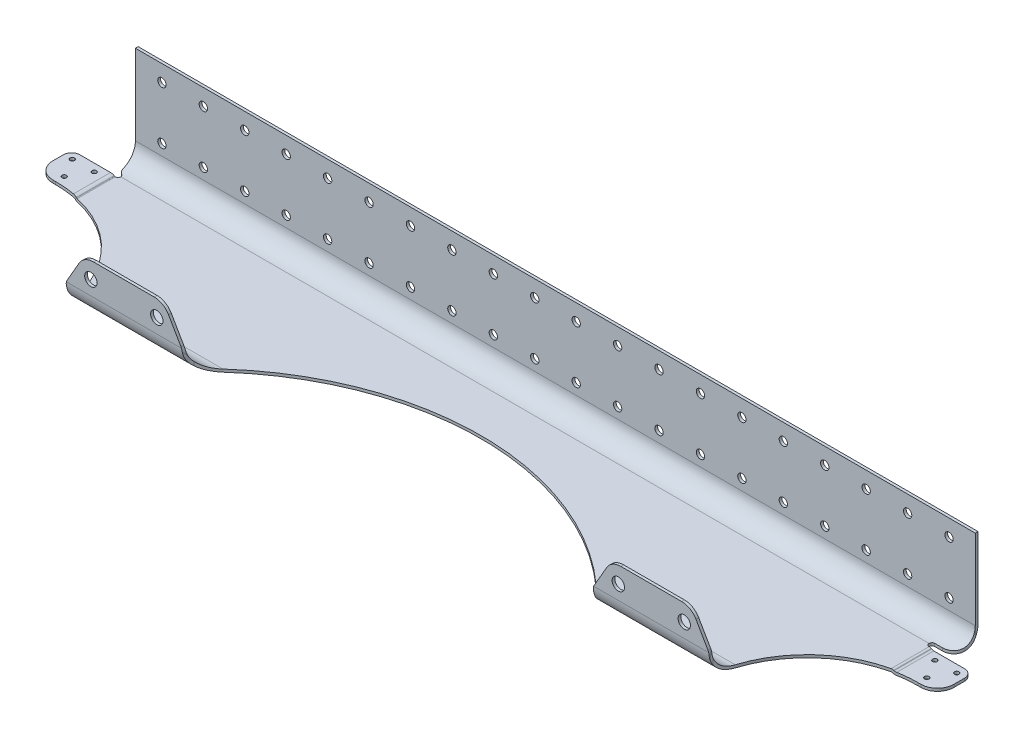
SolidWorks part; units mm, degrees
ref_plane "Front Plane" through (0, 0, 0) normal (1, 0, 0) x (0, 1, 0)
ref_plane "Top Plane" through (0, 0, 0) normal (0, 0, 1) x (0, 1, 0)
ref_plane "Right Plane" through (0, 0, 0) normal (0, 1, 0) x (-1, 0, 0)
sketch "sk 5dia hole pat" plane through (0, 0, 0) normal (0, 0, 1) x (0, 1, 0)
  line L4 (-30.48, -48.26) -> (30.48, -48.26) construction
  point P3 (0, -48.26)
  circle B0 centre (30.48, -579.12) radius 4.826
  circle B1 centre (1188.72, 579.12) radius 4.826
  circle B2 centre (78.74, -579.12) radius 4.826
  circle B3 centre (127, -579.12) radius 4.826
  circle B4 centre (175.26, -579.12) radius 4.826
  circle B5 centre (223.52, -579.12) radius 4.826
  circle B6 centre (271.78, -579.12) radius 4.826
  circle B7 centre (320.04, -579.12) radius 4.826
  circle B8 centre (368.3, -579.12) radius 4.826
  circle B9 centre (416.56, -579.12) radius 4.826
  circle B10 centre (464.82, -579.12) radius 4.826
  circle B11 centre (513.08, -579.12) radius 4.826
  circle B12 centre (561.34, -579.12) radius 4.826
  circle B13 centre (609.6, -579.12) radius 4.826
  circle B14 centre (657.86, -579.12) radius 4.826
  circle B15 centre (706.12, -579.12) radius 4.826
  circle B16 centre (754.38, -579.12) radius 4.826
  circle B17 centre (802.64, -579.12) radius 4.826
  circle B18 centre (850.9, -579.12) radius 4.826
  circle B19 centre (899.16, -579.12) radius 4.826
  circle B20 centre (947.42, -579.12) radius 4.826
  circle B21 centre (995.68, -579.12) radius 4.826
  circle B22 centre (1043.94, -579.12) radius 4.826
  circle B23 centre (1092.2, -579.12) radius 4.826
  circle B24 centre (1140.46, -579.12) radius 4.826
  circle B25 centre (1188.72, -579.12) radius 4.826
  circle B26 centre (30.48, -530.86) radius 4.826
  circle B27 centre (30.48, -482.6) radius 4.826
  circle B28 centre (30.48, -434.34) radius 4.826
  circle B29 centre (30.48, -386.08) radius 4.826
  circle B30 centre (30.48, -337.82) radius 4.826
  circle B31 centre (30.48, -289.56) radius 4.826
  circle B32 centre (30.48, -241.3) radius 4.826
  circle B33 centre (30.48, -193.04) radius 4.826
  circle B34 centre (30.48, -144.78) radius 4.826
  circle B35 centre (30.48, -96.52) radius 4.826
  circle B36 centre (30.48, -48.26) radius 4.826
  circle B37 centre (30.48, 0) radius 4.826
  circle B38 centre (30.48, 48.26) radius 4.826
  circle B39 centre (30.48, 96.52) radius 4.826
  circle B40 centre (30.48, 144.78) radius 4.826
  circle B41 centre (30.48, 193.04) radius 4.826
  circle B42 centre (30.48, 241.3) radius 4.826
  circle B43 centre (30.48, 289.56) radius 4.826
  circle B44 centre (30.48, 337.82) radius 4.826
  circle B45 centre (30.48, 386.08) radius 4.826
  circle B46 centre (30.48, 434.34) radius 4.826
  circle B47 centre (30.48, 482.6) radius 4.826
  circle B48 centre (30.48, 530.86) radius 4.826
  circle B49 centre (30.48, 579.12) radius 4.826
  circle B50 centre (1140.46, 579.12) radius 4.826
  circle B51 centre (1092.2, 579.12) radius 4.826
  circle B52 centre (1043.94, 579.12) radius 4.826
  circle B53 centre (995.68, 579.12) radius 4.826
  circle B54 centre (947.42, 579.12) radius 4.826
  circle B55 centre (899.16, 579.12) radius 4.826
  circle B56 centre (850.9, 579.12) radius 4.826
  circle B57 centre (802.64, 579.12) radius 4.826
  circle B58 centre (754.38, 579.12) radius 4.826
  circle B59 centre (706.12, 579.12) radius 4.826
  circle B60 centre (657.86, 579.12) radius 4.826
  circle B61 centre (609.6, 579.12) radius 4.826
  circle B62 centre (561.34, 579.12) radius 4.826
  circle B63 centre (513.08, 579.12) radius 4.826
  circle B64 centre (464.82, 579.12) radius 4.826
  circle B65 centre (416.56, 579.12) radius 4.826
  circle B66 centre (368.3, 579.12) radius 4.826
  circle B67 centre (320.04, 579.12) radius 4.826
  circle B68 centre (271.78, 579.12) radius 4.826
  circle B69 centre (223.52, 579.12) radius 4.826
  circle B70 centre (175.26, 579.12) radius 4.826
  circle B71 centre (127, 579.12) radius 4.826
  circle B72 centre (78.74, 579.12) radius 4.826
  circle B73 centre (1188.72, 530.86) radius 4.826
  circle B74 centre (1188.72, 482.6) radius 4.826
  circle B75 centre (1188.72, 434.34) radius 4.826
  circle B76 centre (1188.72, 386.08) radius 4.826
  circle B77 centre (1188.72, 337.82) radius 4.826
  circle B78 centre (1188.72, 289.56) radius 4.826
  circle B79 centre (1188.72, 241.3) radius 4.826
  circle B80 centre (1188.72, 193.04) radius 4.826
  circle B81 centre (1188.72, 144.78) radius 4.826
  circle B82 centre (1188.72, 96.52) radius 4.826
  circle B83 centre (1188.72, 48.26) radius 4.826
  circle B84 centre (1188.72, 0) radius 4.826
  circle B85 centre (1188.72, -48.26) radius 4.826
  circle B86 centre (1188.72, -96.52) radius 4.826
  circle B87 centre (1188.72, -144.78) radius 4.826
  circle B88 centre (1188.72, -193.04) radius 4.826
  circle B89 centre (1188.72, -241.3) radius 4.826
  circle B90 centre (1188.72, -289.56) radius 4.826
  circle B91 centre (1188.72, -337.82) radius 4.826
  circle B92 centre (1188.72, -386.08) radius 4.826
  circle B93 centre (1188.72, -434.34) radius 4.826
  circle B94 centre (1188.72, -482.6) radius 4.826
  circle B95 centre (1188.72, -530.86) radius 4.826
  line B96 (609.6, -579.12) -> (609.6, -504.12) construction
  line B97 (30.48, 0) -> (105.48, 0) construction
  circle B98 centre (-30.48, 579.12) radius 4.826
  circle B99 centre (-175.26, -579.12) radius 4.826
  circle B100 centre (-127, -579.12) radius 4.826
  circle B101 centre (-30.48, -579.12) radius 4.826
  circle B102 centre (-1188.72, 96.52) radius 4.826
  circle B103 centre (-127, 579.12) radius 4.826
  circle B104 centre (-464.82, 579.12) radius 4.826
  circle B105 centre (-513.08, 579.12) radius 4.826
  circle B106 centre (-706.12, 579.12) radius 4.826
  circle B107 centre (-754.38, 579.12) radius 4.826
  circle B108 centre (-899.16, 579.12) radius 4.826
  circle B109 centre (-30.48, 530.86) radius 4.826
  circle B110 centre (-30.48, 482.6) radius 4.826
  circle B111 centre (-30.48, 434.34) radius 4.826
  circle B112 centre (-30.48, 386.08) radius 4.826
  circle B113 centre (-30.48, 337.82) radius 4.826
  circle B114 centre (-30.48, 289.56) radius 4.826
  circle B115 centre (-30.48, 241.3) radius 4.826
  circle B116 centre (-30.48, 193.04) radius 4.826
  circle B117 centre (-30.48, 144.78) radius 4.826
  circle B118 centre (-30.48, 96.52) radius 4.826
  circle B119 centre (-30.48, 48.26) radius 4.826
  circle B120 centre (-30.48, 0) radius 4.826
  circle B121 centre (-30.48, -48.26) radius 4.826
  circle B122 centre (-30.48, -96.52) radius 4.826
  circle B123 centre (-30.48, -144.78) radius 4.826
  circle B124 centre (-30.48, -241.3) radius 4.826
  circle B125 centre (-30.48, -289.56) radius 4.826
  circle B126 centre (-30.48, -337.82) radius 4.826
  circle B127 centre (-30.48, -386.08) radius 4.826
  circle B128 centre (-30.48, -434.34) radius 4.826
  circle B129 centre (-30.48, -482.6) radius 4.826
  circle B130 centre (-30.48, -530.86) radius 4.826
  line B131 (-1188.72, 0) -> (-1113.72, 0) construction
  dimension "D1" = 60.96
sketch_block_instance "5dia hole pat-1"
sketch_block "5dia hole pat" parameters "D1"=9.652, "D2"=9.652, "D3"=75
sketch_block_instance "5dia hole pat-2"
sketch "sk 47.986in pnl" plane through (0, 0, 0) normal (0, 0, 1) x (0, 1, 0)
  line B0 (0.1778, 0) -> (1219.0222, 0) construction
  line B1 (0.1778, 609.4222) -> (1219.0222, 609.4222)
  line B2 (0.1778, 609.4222) -> (0.1778, -609.4222)
  line B3 (0.1778, -609.4222) -> (1219.0222, -609.4222)
  line B4 (1219.0222, 609.4222) -> (1219.0222, -609.4222)
  line B5 (609.6, 609.4222) -> (609.6, -609.4222) construction
  dimension "D1" = 30.3022
sketch_block_instance "47.986in pnl-1"
sketch_block "47.986in pnl" parameters "D1"=1218.8444, "D2"=1218.8444
sketch "sk main body" plane through (0, 0, 0) normal (1, 0, 0) x (0, 1, 0)
  line L0 (49.53, 0) -> (-43.18, 0)
  line L1 (-68.58, 25.4) -> (-68.58, 158.75)
  line L2 (-43.18, 184.15) -> (-7.62, 184.15)
  line L3 (-26.67, 213.8401) -> (-26.67, 147.2198) construction
  line L4 (49.53, 3.175) -> (-43.18, 3.175)
  line L5 (-65.405, 25.4) -> (-65.405, 158.75)
  line L6 (-43.18, 180.975) -> (-7.62, 180.975)
  line L7 (-7.62, 184.15) -> (-7.62, 180.975)
  line L8 (49.53, 3.175) -> (49.53, 0)
  line L9 (670.3644, 0) -> (-670.3644, 0) construction
  arc A0 (-43.18, 0) -> (-68.58, 25.4) centre (-43.18, 25.4) cw
  arc A1 (-68.58, 158.75) -> (-43.18, 184.15) centre (-43.18, 158.75) cw
  arc A2 (-43.18, 3.175) -> (-65.405, 25.4) centre (-43.18, 25.4) cw
  arc A3 (-65.405, 158.75) -> (-43.18, 180.975) centre (-43.18, 158.75) cw
  dimension "D2" = 25.4
  dimension "D1" = 19.05
  dimension "D3" = 12.7
  dimension "D4" = 16.51
  dimension "D5" = 19.05
  dimension "D7" = 177.8
  dimension "D6" = 3.175
extrude "main body" add sketch "sk main body" along normal mid plane 996.48
sketch "sk upper holes" plane through (0, 0, 184.15) normal (0, 0, 1) x (1, 0, 0)
  line L0 (-609.4222, 0.1778) -> (-609.4222, 1219.0222) construction
  line L1 (609.4222, 0.1778) -> (609.4222, 1219.0222) construction
  line L2 (498.24, -7.62) -> (-498.24, -7.62) construction
  circle A2 centre (-342.9, -26.67) radius 16.51 construction
  circle A3 centre (-266.7, -26.67) radius 16.51 construction
  circle A4 centre (266.7, -26.67) radius 16.51 construction
  circle A5 centre (342.9, -26.67) radius 16.51 construction
  line B0 (-342.9, -26.67) -> (-266.7, -26.67) construction
  circle B1 centre (-342.9, -26.67) radius 7.1438
  circle B2 centre (-266.7, -26.67) radius 7.1438
  line B3 (266.7, -26.67) -> (342.9, -26.67) construction
  circle B4 centre (266.7, -26.67) radius 7.1438
  circle B5 centre (342.9, -26.67) radius 7.1438
  dimension "D1" = 304.8
  dimension "D2" = 304.8
  dimension "D6" = 33.02
  dimension "D7" = 33.02
  dimension "D8" = 33.02
  dimension "D9" = 33.02
  dimension "D3" = 304.6222
  dimension "D4" = 304.6222
  dimension "D5" = 19.05
sketch_block_instance "Upper bolt holes-1"
sketch_block "Upper bolt holes" parameters "D1"=14.2875, "D2"=14.2875, "D3"=76.2
sketch_block_instance "Upper bolt holes-2"
sketch "Sketch6" plane through (0, 0, 184.15) normal (0, 0, 1) x (1, 0, 0)
  line L0 (-371.4962, -43.18) -> (-304.8, 72.3411)
  line L1 (498.24, -43.18) -> (-498.24, -43.18) construction
  line L2 (-304.8, 72.3411) -> (-238.1038, -43.18)
  line L3 (-371.4962, -43.18) -> (-638.8127, -43.18)
  line L4 (-638.8127, -43.18) -> (-638.8127, 115.8831)
  line L6 (238.1038, -43.18) -> (304.8, 72.3411)
  line L7 (304.8, 72.3411) -> (371.4962, -43.18)
  line L8 (371.4962, -43.18) -> (645.1619, -43.18)
  line L9 (645.1619, -43.18) -> (645.1619, 115.8831)
  line L10 (-238.1038, -43.18) -> (238.1038, -43.18)
  line L11 (-638.8127, 115.8831) -> (645.1619, 115.8831)
  circle A0 centre (-342.9, -26.67) radius 16.51 construction
  circle A1 centre (-266.7, -26.67) radius 16.51 construction
  circle A2 centre (342.9, -26.67) radius 16.51 construction
  circle A3 centre (266.7, -26.67) radius 16.51 construction
  dimension "D1" = 60
  dimension "D2" = 60
  dimension "D3" = 60
  dimension "D4" = 60
extrude "Upper tabs" cut sketch "Sketch6" against normal blind 10
sketch "Sketch7" plane through (0, 0, 0) normal (0, 1, 0) x (-1, 0, 0)
  line L0 (-238.1038, 180.975) -> (-238.1038, 196.2087)
  line L4 (-238.1038, 196.2087) -> (238.1038, 196.2087)
  line L5 (238.1038, 196.2087) -> (238.1038, 180.975)
  line L6 (-498.24, 25.4) -> (498.24, 25.4) construction
  arc A2 (-238.1038, 180.975) -> (238.1038, 180.975) centre (0, 399.136) ccw
  point P2 (0, 76.2)
  dimension "D1" = 50.8
extrude "Side Mid curve" cut sketch "Sketch7" against normal through all
sketch "5dia hole for part" plane through (0, 0, 0) normal (0, 0, 1) x (0, 1, 0)
  line L0 (49.53, -498.24) -> (-43.18, -498.24) construction
  line L1 (49.53, -498.24) -> (49.53, 498.24) construction
  line L2 (-43.18, -498.24) -> (-43.18, 498.24) construction
  circle A52 centre (-30.48, -467.9378) radius 4.826
  circle A53 centre (30.48, -467.9378) radius 4.826
  circle A54 centre (30.48, -420.0588) radius 4.826
  circle A55 centre (-30.48, -420.0588) radius 4.826
  circle A56 centre (30.48, -372.1798) radius 4.826
  circle A57 centre (-30.48, -372.1798) radius 4.826
  circle A58 centre (30.48, -324.3008) radius 4.826
  circle A59 centre (-30.48, -324.3008) radius 4.826
  circle A60 centre (30.48, -276.4218) radius 4.826
  circle A61 centre (-30.48, -276.4218) radius 4.826
  circle A62 centre (30.48, -228.5428) radius 4.826
  circle A63 centre (-30.48, -228.5428) radius 4.826
  circle A64 centre (30.48, -180.6638) radius 4.826
  circle A65 centre (-30.48, -180.6638) radius 4.826
  circle A66 centre (30.48, -132.7848) radius 4.826
  circle A67 centre (-30.48, -132.7848) radius 4.826
  circle A68 centre (30.48, -84.9058) radius 4.826
  circle A69 centre (-30.48, -84.9058) radius 4.826
  circle A70 centre (30.48, -37.0268) radius 4.826
  circle A71 centre (-30.48, -37.0268) radius 4.826
  circle A72 centre (30.48, 10.8522) radius 4.826
  circle A73 centre (-30.48, 10.8522) radius 4.826
  circle A74 centre (30.48, 58.7312) radius 4.826
  circle A75 centre (-30.48, 58.7312) radius 4.826
  circle A76 centre (30.48, 106.6102) radius 4.826
  circle A77 centre (-30.48, 106.6102) radius 4.826
  circle A78 centre (30.48, 154.4892) radius 4.826
  circle A79 centre (-30.48, 154.4892) radius 4.826
  circle A80 centre (30.48, 202.3682) radius 4.826
  circle A81 centre (-30.48, 202.3682) radius 4.826
  circle A82 centre (30.48, 250.2472) radius 4.826
  circle A83 centre (-30.48, 250.2472) radius 4.826
  circle A84 centre (30.48, 298.1262) radius 4.826
  circle A85 centre (-30.48, 298.1262) radius 4.826
  circle A86 centre (30.48, 346.0052) radius 4.826
  circle A87 centre (-30.48, 346.0052) radius 4.826
  circle A88 centre (30.48, 393.8842) radius 4.826
  circle A89 centre (-30.48, 393.8842) radius 4.826
  circle A90 centre (30.48, 441.7632) radius 4.826
  circle A91 centre (-30.48, 441.7632) radius 4.826
  dimension "D4" = 9.652
  dimension "D5" = 9.652
  dimension "D1" = 30.3022
  dimension "D2" = 19.05
  dimension "D3" = 12.7
  dimension "D6" = 20
extrude "Holes Bot" cut sketch "5dia hole for part" along normal blind 10
extrude "Holes Top" cut sketch "sk upper holes" against normal blind 10
ref_plane "Tab Lower pln" through (0, 0, 25.4) normal (0, 0, 1) x (0, 1, 0)
sketch "sk Rivet holes" plane through (0, 0, 0) normal (0, 1, 0) x (-1, 0, 0)
  line L1 (498.24, 0) -> (498.24, 3.175) construction
  line L3 (64.9605, 25.4) -> (-64.9605, 25.4) construction
  line L5 (-498.24, 25.4) -> (-498.24, 158.75) construction
  circle A0 centre (511.1178, 37.4) radius 10 construction
  circle A1 centre (498.4178, 59.397) radius 10 construction
  circle A2 centre (485.7178, 37.4) radius 10 construction
  circle A3 centre (-498.4178, 59.397) radius 10 construction
  circle A4 centre (-485.7178, 37.4) radius 10 construction
  circle A6 centre (-511.1178, 37.4) radius 10 construction
  point P5 (511.1178, 34.8092)
  point P9 (511.1178, 27.4)
  point P20 (521.1178, 37.4)
  point P21 (-521.1178, 37.4)
  point P22 (475.7178, 37.4)
  point P23 (-475.7178, 37.4)
  point P24 (498.4178, 69.397)
  point P25 (-498.4178, 69.397)
  line B0 (485.7178, 37.4) -> (498.4178, 59.397) construction
  line B1 (498.4178, 59.397) -> (511.1178, 37.4) construction
  line B2 (511.1178, 37.4) -> (485.7178, 37.4) construction
  circle B3 centre (485.7178, 37.4) radius 2.5908
  circle B4 centre (511.1178, 37.4) radius 2.5908
  circle B5 centre (498.4178, 59.397) radius 2.5908
  line B6 (492.0678, 48.3985) -> (498.4178, 44.7323) construction
  line B7 (498.4178, 37.4) -> (498.4178, 44.7323) construction
  line B8 (-511.1178, 37.4) -> (-498.4178, 59.397) construction
  line B9 (-498.4178, 59.397) -> (-485.7178, 37.4) construction
  line B10 (-485.7178, 37.4) -> (-511.1178, 37.4) construction
  circle B11 centre (-511.1178, 37.4) radius 2.5908
  circle B12 centre (-485.7178, 37.4) radius 2.5908
  circle B13 centre (-498.4178, 59.397) radius 2.5908
  line B14 (-504.7678, 48.3985) -> (-498.4178, 44.7323) construction
  line B15 (-498.4178, 37.4) -> (-498.4178, 44.7323) construction
  dimension "D4" = 20
  dimension "D6" = 20
  dimension "D7" = 20
  dimension "D8" = 20
  dimension "D9" = 20
  dimension "D10" = 20
  dimension "D1" = 0.1778
  dimension "D2" = 12
  dimension "D3" = 0.1778
  dimension "D5" = 7.4092
sketch_block_instance "Blind Rivet holes-1"
sketch_block "Blind Rivet holes" parameters "D1"=5.1816, "D2"=5.1816, "D3"=5.1816, "D4"=60, "D5"=60, "D6"=25.4, "D7"=25.4, "D8"=25.4
sketch_block_instance "Blind Rivet holes-2"
sketch "sk Vtab" plane through (0, 0, 25.4) normal (0, 0, 1) x (0, 1, 0)
  line L8 (-68.58, -498.24) -> (-68.58, 498.24) construction
  line B0 (-68.58, 468.2887) -> (-68.58, 470.2887)
  line B1 (-67.9101, 472.7887) -> (-67.6624, 473.2178)
  line B2 (-66.9925, 475.7178) -> (-66.9925, 520.7178)
  line B3 (-65.405, 468.2887) -> (-65.405, 470.2887)
  line B4 (-65.1605, 471.2012) -> (-64.9127, 471.6303)
  line B5 (-63.8175, 475.7178) -> (-63.8175, 520.7178)
  line B6 (-68.58, 468.2887) -> (-65.405, 468.2887)
  line B7 (-63.8175, 520.7178) -> (-66.9925, 520.7178)
  arc B8 (-67.6624, 473.2178) -> (-66.9925, 475.7178) centre (-71.9925, 475.7178) ccw
  arc B9 (-68.58, 470.2887) -> (-67.9101, 472.7887) centre (-63.58, 470.2887) cw
  arc B10 (-65.405, 470.2887) -> (-65.1605, 471.2012) centre (-63.58, 470.2887) cw
  arc B11 (-64.9127, 471.6303) -> (-63.8175, 475.7178) centre (-71.9925, 475.7178) ccw
  line B12 (-65.405, -468.2887) -> (-65.405, -470.2887)
  line B13 (-66.0749, -472.7887) -> (-66.3226, -473.2178)
  line B14 (-66.9925, -475.7178) -> (-66.9925, -520.7178)
  line B15 (-68.58, -468.2887) -> (-68.58, -470.2887)
  line B16 (-68.8245, -471.2012) -> (-69.0723, -471.6303)
  line B17 (-70.1675, -475.7178) -> (-70.1675, -520.7178)
  line B18 (-65.405, -468.2887) -> (-68.58, -468.2887)
  line B19 (-70.1675, -520.7178) -> (-66.9925, -520.7178)
  arc B20 (-66.3226, -473.2178) -> (-66.9925, -475.7178) centre (-61.9925, -475.7178) ccw
  arc B21 (-65.405, -470.2887) -> (-66.0749, -472.7887) centre (-70.405, -470.2887) cw
  arc B22 (-68.58, -470.2887) -> (-68.8245, -471.2012) centre (-70.405, -470.2887) cw
  arc B23 (-69.0723, -471.6303) -> (-70.1675, -475.7178) centre (-61.9925, -475.7178) ccw
sketch_block_instance "V tab-1"
sketch_block "V tab" parameters "D3"=5, "D1"=30, "D2"=1.5875, "D4"=2, "D5"=24.625
sketch_block_instance "V tab-2"
sketch "sk Vtab precut" plane through (0, 0, 25.4) normal (0, 0, 1) x (0, 1, 0)
  line L1 (-68.58, 470.2887) -> (-25.5629, 470.2887)
  line L2 (-68.58, 470.2887) -> (-68.58, 628.7058)
  line L3 (-68.58, 628.7058) -> (-25.5629, 628.7058)
  line L4 (-25.5629, 470.2887) -> (-25.5629, 628.7058)
  line L5 (-68.58, -470.2887) -> (-35.8904, -470.2887)
  line L6 (-68.58, -470.2887) -> (-68.58, -622.8382)
  line L7 (-68.58, -622.8382) -> (-35.8904, -622.8382)
  line L8 (-35.8904, -470.2887) -> (-35.8904, -622.8382)
sketch "Sketch9" plane through (0, 0, 0) normal (0, 1, 0) x (-1, 0, 0)
  line L6 (371.4962, 180.975) -> (371.4962, 193.3104)
  line L7 (371.4962, 193.3104) -> (736.1624, 193.3104)
  line L8 (736.1624, 193.3104) -> (736.1624, 69.397)
  line L9 (736.1624, 69.397) -> (498.4178, 69.397)
  line L10 (-371.4962, 180.975) -> (-371.4962, 190.6931)
  line L11 (-371.4962, 190.6931) -> (-686.7988, 190.6931)
  line L12 (-686.7988, 190.6931) -> (-686.7988, 69.397)
  line L13 (-686.7988, 69.397) -> (-498.4178, 69.397)
  arc A2 (371.4962, 180.975) -> (498.4178, 69.397) centre (498.4178, 197.3737) ccw
  arc A3 (-371.4962, 180.975) -> (-498.4178, 69.397) centre (-498.4178, 197.3737) cw
  circle A4 centre (-498.4178, 59.397) radius 10 construction
extrude "Cut-Extrude5" cut sketch "sk Vtab precut" along normal through all
extrude "Side Tabs" add sketch "sk Vtab" along normal blind 50
sketch "Sketch11" plane through (0, 0, 0) normal (0, 1, 0) x (-1, 0, 0)
  line L0 (470.2887, 25.4) -> (667.6325, 25.4) construction
  line L1 (470.2887, 28.575) -> (667.6325, 28.575)
  line L2 (470.2887, 22.225) -> (667.6325, 22.225)
  line L4 (-470.2887, 25.4) -> (470.2887, 25.4) construction
  line L5 (470.2887, 75.4) -> (470.2887, 25.4) construction
  line L6 (-470.2887, 25.4) -> (-658.6998, 25.4) construction
  line L7 (-470.2887, 22.225) -> (-658.6998, 22.225)
  line L8 (-470.2887, 28.575) -> (-658.6998, 28.575)
  line L9 (-470.2887, 25.4) -> (-470.2887, 75.4) construction
  arc A0 (470.2887, 28.575) -> (470.2887, 22.225) centre (470.2887, 25.4) ccw
  arc A1 (667.6325, 22.225) -> (667.6325, 28.575) centre (667.6325, 25.4) ccw
  arc A2 (-470.2887, 22.225) -> (-470.2887, 28.575) centre (-470.2887, 25.4) ccw
  arc A3 (-658.6998, 28.575) -> (-658.6998, 22.225) centre (-658.6998, 25.4) ccw
  point P2 (568.9606, 25.4)
  point P7 (-564.4942, 25.4)
  dimension "D1" = 3.175
  dimension "D2" = 3.175
extrude "tab undercut" cut sketch "Sketch11" against normal through all
extrude "Outer curve cut" cut sketch "Sketch9" against normal through all
fillet "Fillet1" radius 19.05 12 edges at (-498.24, -66.7789, 22.225) (498.24, -66.7789, 22.225) (520.7178, -68.58, 69.397) (-520.7178, -65.405, 69.397) (-371.4962, -49.3284, 180.975) (-238.1038, -49.3284, 180.975) (371.4962, -49.3284, 180.975) (238.1038, -49.3284, 180.975) (350.9656, -7.62, 182.5625) (258.6344, -7.62, 182.5625) (-258.6344, -7.62, 182.5625) (-350.9656, -7.62, 182.5625)
fillet "Fillet3" radius 9.525 8 edges at (520.7178, -68.58, 28.575) (-520.7178, -65.405, 28.575) (237.1094, -44.9024, 182.4383) (371.5068, -43.1985, 181.6122) (-237.1094, -44.9024, 182.4383) (-371.5068, -43.1985, 181.6122) (371.4962, -43.18, 183.2001) (-371.4962, -43.18, 183.2001)
extrude "Tab Holes" cut sketch "sk Rivet holes" against normal through all
sketch "Sketch13" plane through (0, 0, 0) normal (0, 1, 0) x (-1, 0, 0)
  line L0 (498.24, 0) -> (498.24, 3.175) construction
  line L1 (472.4146, 24.2519) -> (501.2264, 24.2519)
  line L2 (472.4146, 24.2519) -> (472.4146, -10.4947)
  line L3 (472.4146, -10.4947) -> (501.2264, -10.4947)
  line L4 (501.2264, 24.2519) -> (501.2264, -10.4947)
  dimension "D1" = 25.8254
extrude "Cut-Extrude7" cut sketch "Sketch13" against normal through all both and the other way through all
fillet "Fillet5" radius 6.35 1 edges at (-472.4146, -66.7789, 22.225)
equation "\"3i\"=138.375"
equation "\".75i\"=12.7"
